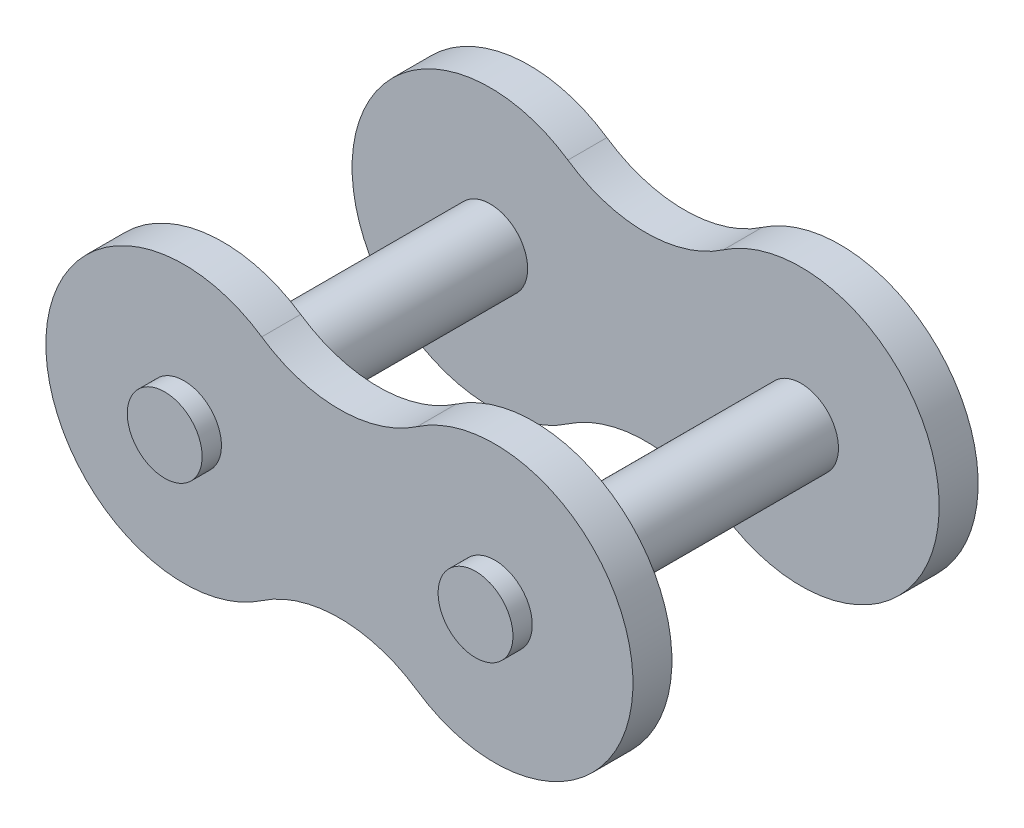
SolidWorks part; units mm, degrees
ref_plane "Plan de face" through (0, 0, 0) normal (0, 0, 1) x (1, 0, 0)
ref_plane "Plan de dessus" through (0, 0, 0) normal (0, 1, 0) x (1, 0, 0)
ref_plane "Plan de droite" through (0, 0, 0) normal (1, 0, 0) x (0, 0, -1)
imported_body "Importée1"
sketch "Esquisse1" plane through (0, 0, 6.815) normal (0, 0, 1) x (1, 0, 0)
  line L1 (-7.6918, 8.7932) -> (24.4224, 8.7932)
  line L2 (-7.6918, 8.7932) -> (-7.6918, -11.1963)
  line L3 (-7.6918, -11.1963) -> (24.4224, -11.1963)
  line L4 (24.4224, 8.7932) -> (24.4224, -11.1963)
  circle A0 centre (15.88, 0) radius 1.915
  dimension "D1" = 3.83
  dimension "D2" = 15.88
extrude "Enlèv. mat.-Extru.1" cut sketch "Esquisse1" against normal up to surface (13.64 mm away)
